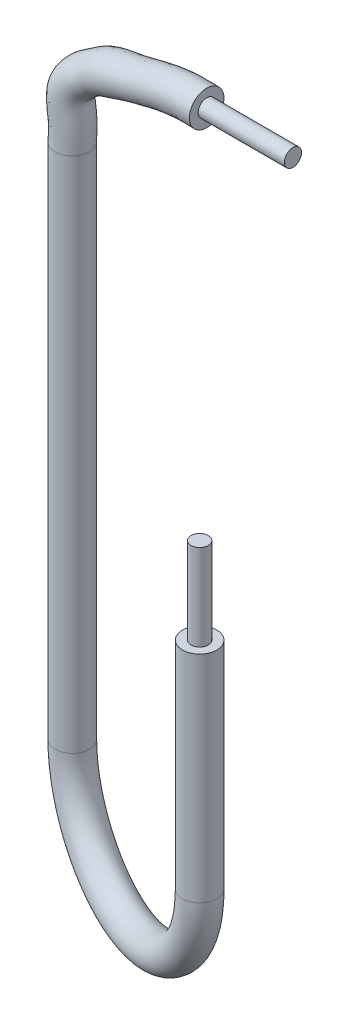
SolidWorks part; units mm, degrees
ref_plane "Plan de face" through (0, 0, 0) normal (0, 0, 1) x (1, 0, 0)
ref_plane "Plan de dessus" through (0, 0, 0) normal (0, 1, 0) x (1, 0, 0)
ref_plane "Plan de droite" through (0, 0, 0) normal (1, 0, 0) x (0, 0, -1)
sketch "Esquisse2" plane through (0, -29.6939, 0) normal (0, -1, 0) x (1, 0, 0)
  line L0 (0, 4.5) -> (0, 0) construction
  circle A0 centre (0, 4.5) radius 1
  dimension "D1" = 2
  dimension "D2" = 4.5
extrude "Extrusion1" add sketch "Esquisse2" along normal blind 10
sketch "Esquisse3" plane through (0, -39.6939, 0) normal (0, -1, 0) x (1, 0, 0)
  line L4 (-8.0307, 9.7099) -> (-4.0819, -1.8731) construction
  circle A0 centre (0, 4.5) radius 1
  dimension "D1" = 5.92
revolve "Révolution1" add sketch "Esquisse3" angle 180 about L4
sketch "Esquisse4" plane through (0, -39.6939, 0) normal (0, 1, 0) x (-1, 0, 0)
  circle A0 centre (11.2067, 0.6795) radius 1
extrude "Extrusion2" add sketch "Esquisse4" along normal blind 30
sketch3d "Esquisse3D1"
  line L5 (-11.2067, -9.6939, 0.6795) -> (-11.2067, -39.6939, 0.6795) construction
  spline S0 degree 3 poles (-11.2067, -9.6939, 0.6795) (-11.1891, -9.2552, 0.6752) (-11.1522, -8.334, 0.666) (-11.4763, -6.6758, 0.7462) (-9.7759, -5.3918, 0.3258) (-7.5428, -4.8666, 0.4828) (-5.2811, -4.2225, 0.4315) (-2.9384, -4.389, 0.4407) (-0.098, -4.3361, 0.4374) (2.1787, -4.3278, 0.4381) (3.6642, -4.3224, 0.4386) knots 0 0 0 0 0.072587 0.152403 0.252721 0.376288 0.53599 0.628444 0.757584 1 1 1 1
  point P3 (0, 0, 0)
  point P7 (-13.3968, -2.9029, 1.6039)
sketch "Esquisse6" plane through (0, -9.6939, 0) normal (0, 1, 0) x (-1, 0, 0)
  circle A0 centre (11.2067, 0.6795) radius 1
sweep "Balayage2" add profiles "Esquisse6" path "Esquisse3D1"
sketch "Esquisse8" plane through (0, -29.6939, 0) normal (0, 1, 0) x (-1, 0, 0)
  circle A0 centre (0, 4.5) radius 1
  circle A1 centre (0, 4.5) radius 1 construction
extrude "Extrusion4" add sketch "Esquisse8" along normal blind 2.5
sketch "Esquisse9" plane through (0, -27.1939, 0) normal (0, 1, 0) x (-1, 0, 0)
  circle A0 centre (0, 4.5) radius 0.5
  dimension "D1" = 1
extrude "Extrusion5" add sketch "Esquisse9" along normal blind 5
sketch "Esquisse10" plane through (0, 0, 0) normal (0, 0, 1) x (1, 0, 0)
  line L1 (-3.657, -2.5274) -> (5.7497, -2.5274)
  line L2 (-3.657, -2.5274) -> (-3.657, -5.9971)
  line L3 (-3.657, -5.9971) -> (5.7497, -5.9971)
  line L4 (5.7497, -2.5274) -> (5.7497, -5.9971)
extrude "Enlèv. mat.-Extru.1" cut sketch "Esquisse10" against normal mid plane 30
sketch "Esquisse12" plane through (-3.657, 0, 0) normal (1, 0, 0) x (0, 0, -1)
  circle A0 centre (-0.433, -4.3211) radius 0.5
  dimension "D1" = 1
extrude "Boss.-Extru.1" add sketch "Esquisse12" along normal blind 5
